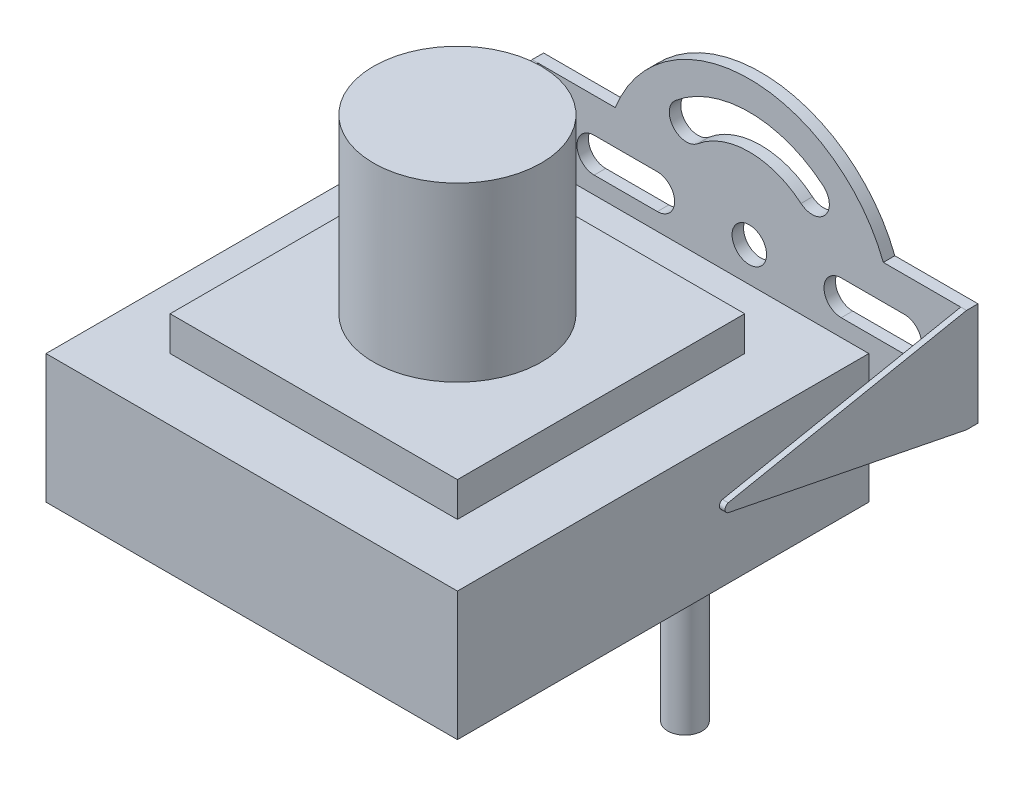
SolidWorks part; units mm, degrees
ref_plane "前视基准面" through (0, 0, 0) normal (0, 0, 1) x (1, 0, 0)
ref_plane "上视基准面" through (0, 0, 0) normal (0, 1, 0) x (1, 0, 0)
ref_plane "右视基准面" through (0, 0, 0) normal (1, 0, 0) x (0, 0, -1)
sketch "草图1" plane through (0, 0, 0) normal (0, 1, 0) x (1, 0, 0)
  line L1 (-17.9, -17.9) -> (17.9, -17.9)
  line L2 (-17.9, -17.9) -> (-17.9, 17.9)
  line L3 (-17.9, 17.9) -> (17.9, 17.9)
  line L4 (17.9, -17.9) -> (17.9, 17.9)
  line L5 (-17.9, -17.9) -> (17.9, 17.9) construction
  line L6 (-17.9, 17.9) -> (17.9, -17.9) construction
  point P0 (0, 0)
  dimension "D1" = 35.8
  dimension "D2" = 35.8
extrude "凸台-拉伸1" add sketch "草图1" along normal blind 11.2
sketch "草图2" plane through (0, 11.2, 0) normal (0, 1, 0) x (1, 0, 0)
  line L1 (-12.5, -12.5) -> (12.5, -12.5)
  line L2 (-12.5, -12.5) -> (-12.5, 12.5)
  line L3 (-12.5, 12.5) -> (12.5, 12.5)
  line L4 (12.5, -12.5) -> (12.5, 12.5)
  line L5 (-12.5, -12.5) -> (12.5, 12.5) construction
  line L6 (-12.5, 12.5) -> (12.5, -12.5) construction
  point P0 (0, 0)
  dimension "D1" = 25
  dimension "D2" = 25
extrude "凸台-拉伸2" add sketch "草图2" along normal blind 3
sketch "草图3" plane through (0, 14.2, 0) normal (0, 1, 0) x (1, 0, 0)
  circle A0 centre (0, 0) radius 7.3
  dimension "D1" = 14.6
extrude "凸台-拉伸3" add sketch "草图3" along normal blind 15
sketch "草图4" plane through (-17.9, 0, 0) normal (-1, 0, 0) x (0, 0, 1)
  line L0 (0, 0) -> (0, 8.5399) construction
  line L1 (-17.9, 0) -> (17.9, 0) construction
  line L2 (0, 0) -> (0, -7.5222) construction
  line L3 (-4.5, -7.5222) -> (4.5, -7.5222)
  line L4 (4.5, -7.5222) -> (1.2255, 8.786)
  line L5 (-4.5, -7.5222) -> (-1.2255, 8.786)
  arc A0 (1.2255, 8.786) -> (-1.2255, 8.786) centre (0, 8.5399) ccw
  dimension "D1" = 2.5
  dimension "D2" = 9
extrude "凸台-拉伸4" [suppressed] add sketch "草图4" along normal blind 0.5
mirror "镜向1" [suppressed] about plane through (0, 0, 0) normal (1, 0, 0)
sketch "草图5" [suppressed] plane through (0, -7.5222, 0) normal (0, -1, 0) x (1, 0, 0)
  line L0 (18.4, 4.5) -> (11.6619, 4.5)
  line L1 (18.4, 4.5) -> (18.4, -4.5)
  line L2 (18.4, -4.5) -> (11.6619, -4.5)
  line L3 (0, 0) -> (0, 2.2941) construction
  line L4 (-18.4, -4.5) -> (-11.6619, -4.5)
  line L5 (-18.4, 4.5) -> (-18.4, -4.5)
  line L6 (-18.4, 4.5) -> (-11.6619, 4.5)
  line L7 (-5.4637, 6.5114) -> (0, 0) construction
  line L8 (5.4637, 6.5114) -> (0, 0) construction
  line L9 (0, 0) -> (2.5677, 0) construction
  line L10 (8, 0) -> (13.5, 0) construction
  line L11 (8, 1.5) -> (13.5, 1.5)
  line L12 (8, -1.5) -> (13.5, -1.5)
  line L13 (-8, 0) -> (-13.5, 0) construction
  line L14 (-8, 1.5) -> (-13.5, 1.5)
  line L15 (-8, -1.5) -> (-13.5, -1.5)
  arc A0 (11.6619, 4.5) -> (-11.6619, 4.5) centre (0, 0) ccw
  arc A1 (-11.6619, -4.5) -> (11.6619, -4.5) centre (0, 0) ccw
  circle A2 centre (0, 0) radius 1.5
  circle A3 centre (0, 0) radius 7 construction
  circle A4 centre (0, 0) radius 10 construction
  arc A5 (-5.4637, 6.5114) -> (5.4637, 6.5114) centre (0, 0) cw construction
  arc A6 (6.4279, 7.6604) -> (-6.4279, 7.6604) centre (0, 0) ccw
  arc A7 (4.4995, 5.3623) -> (-4.4995, 5.3623) centre (0, 0) ccw
  arc A8 (4.4995, 5.3623) -> (6.4279, 7.6604) centre (5.4637, 6.5114) ccw
  arc A9 (-6.4279, 7.6604) -> (-4.4995, 5.3623) centre (-5.4637, 6.5114) ccw
  arc A10 (-5.4637, -6.5114) -> (5.4637, -6.5114) centre (0, 0) ccw construction
  arc A11 (6.4279, -7.6604) -> (-6.4279, -7.6604) centre (0, 0) cw
  arc A12 (4.4995, -5.3623) -> (-4.4995, -5.3623) centre (0, 0) cw
  arc A13 (4.4995, -5.3623) -> (6.4279, -7.6604) centre (5.4637, -6.5114) cw
  arc A14 (-6.4279, -7.6604) -> (-4.4995, -5.3623) centre (-5.4637, -6.5114) cw
  arc A15 (8, 1.5) -> (8, -1.5) centre (8, 0) ccw
  arc A16 (13.5, -1.5) -> (13.5, 1.5) centre (13.5, 0) ccw
  arc A17 (-8, 1.5) -> (-8, -1.5) centre (-8, 0) cw
  arc A18 (-13.5, -1.5) -> (-13.5, 1.5) centre (-13.5, 0) cw
  point P19 (0, 8.5)
  point P29 (0, -8.5)
  point P36 (10.75, 0)
  point P43 (-10.75, 0)
  dimension "D1" = 25
  dimension "D2" = 3
  dimension "D3" = 14
  dimension "D5" = 8.5
  dimension "D6" = 1.5
  dimension "D11" = 1.5
  dimension "D7" = 40
  dimension "D8" = 40
  dimension "D9" = 8
  dimension "D10" = 5.5
  dimension "D4" = 3
extrude "凸台-拉伸5" [suppressed] add sketch "草图5" along normal blind 0.5
sketch "草图6" plane through (0, 0, 0) normal (0, -1, 0) x (1, 0, 0)
  line L0 (17.9, 17.9) -> (17.9, -17.9) construction
  line L1 (17.9, -17.9) -> (-17.9, -17.9) construction
  circle A0 centre (6.4, -13.4) radius 1.5
  dimension "D2" = 4.5
  dimension "D3" = 3
  dimension "D1" = 11.5
extrude "凸台-拉伸6" add sketch "草图6" along normal blind 20
ref_plane "基准面1" through (0, 0, -25.4) normal (0, 0, -1) x (-1, 0, 0)
sketch "草图8" plane through (0, 0, -25.4) normal (0, 0, -1) x (-1, 0, 0)
  line L0 (18.4, 11.2) -> (11.6619, 11.2)
  line L1 (18.4, 11.2) -> (18.4, 2.2)
  line L2 (18.4, 2.2) -> (11.6619, 2.2)
  line L3 (0, 6.7) -> (0, 17.2371) construction
  line L4 (-18.4, 2.2) -> (-11.6619, 2.2)
  line L5 (-18.4, 11.2) -> (-18.4, 2.2)
  line L6 (-18.4, 11.2) -> (-11.6619, 11.2)
  line L7 (-5.4637, 13.2114) -> (0, 6.7) construction
  line L8 (5.4637, 13.2114) -> (0, 6.7) construction
  line L9 (0, 6.7) -> (3.055, 6.7) construction
  line L10 (8, 6.7) -> (13.5, 6.7) construction
  line L11 (8, 8.2) -> (13.5, 8.2)
  line L12 (8, 5.2) -> (13.5, 5.2)
  line L13 (-8, 6.7) -> (-13.5, 6.7) construction
  line L14 (-8, 8.2) -> (-13.5, 8.2)
  line L15 (-8, 5.2) -> (-13.5, 5.2)
  line L16 (0, 11.2) -> (0, 6.7) construction
  line L17 (-17.9, 11.2) -> (17.9, 11.2) construction
  arc A0 (11.6619, 11.2) -> (-11.6619, 11.2) centre (0, 6.7) ccw
  arc A1 (-11.6619, 2.2) -> (11.6619, 2.2) centre (0, 6.7) ccw
  circle A2 centre (0, 6.7) radius 1.5
  arc A5 (-5.4637, 13.2114) -> (5.4637, 13.2114) centre (0, 6.7) cw construction
  arc A6 (6.4279, 14.3604) -> (-6.4279, 14.3604) centre (0, 6.7) ccw
  arc A7 (4.4995, 12.0623) -> (-4.4995, 12.0623) centre (0, 6.7) ccw
  arc A8 (4.4995, 12.0623) -> (6.4279, 14.3604) centre (5.4637, 13.2114) ccw
  arc A9 (-6.4279, 14.3604) -> (-4.4995, 12.0623) centre (-5.4637, 13.2114) ccw
  arc A10 (-5.4637, 0.1886) -> (5.4637, 0.1886) centre (0, 6.7) ccw construction
  arc A11 (6.4279, -0.9604) -> (-6.4279, -0.9604) centre (0, 6.7) cw
  arc A12 (4.4995, 1.3377) -> (-4.4995, 1.3377) centre (0, 6.7) cw
  arc A13 (4.4995, 1.3377) -> (6.4279, -0.9604) centre (5.4637, 0.1886) cw
  arc A14 (-6.4279, -0.9604) -> (-4.4995, 1.3377) centre (-5.4637, 0.1886) cw
  arc A15 (8, 8.2) -> (8, 5.2) centre (8, 6.7) ccw
  arc A16 (13.5, 5.2) -> (13.5, 8.2) centre (13.5, 6.7) ccw
  arc A17 (-8, 8.2) -> (-8, 5.2) centre (-8, 6.7) cw
  arc A18 (-13.5, 5.2) -> (-13.5, 8.2) centre (-13.5, 6.7) cw
  point P16 (0, 15.2)
  point P26 (0, -1.8)
  point P33 (10.75, 6.7)
  point P40 (-10.75, 6.7)
  dimension "D2" = 10
  dimension "D3" = 8.5
  dimension "D5" = 12.5
  dimension "D7" = 5.5
  dimension "D8" = 16
  dimension "D9" = 1.5
  dimension "D10" = 1.5
  dimension "D12" = 4.5
  dimension "D13" = 3
  dimension "D1" = 36.8
  dimension "D4" = 40
  dimension "D6" = 9
  dimension "D11" = 40
extrude "凸台-拉伸8" add sketch "草图8" along normal blind 1 separate body
sketch "草图9" plane through (-18.4, 0, 0) normal (-1, 0, 0) x (0, 0, 1)
  line L0 (-25.4, 11.2) -> (-4.66, 7.0749)
  line L2 (-4.66, 6.3251) -> (-25.4, 2.2)
  line L3 (-26.4, 6.7) -> (3.132, 6.7) construction
  line L4 (-26.4, 2.2) -> (-26.4, 11.2) construction
  line L8 (-25.4, 2.2) -> (-25.4, 11.2)
  line L9 (-25.4, 11.2) -> (-26.4, 11.2)
  line L10 (-26.4, 11.2) -> (-26.4, 2.2)
  line L11 (-26.4, 2.2) -> (-25.4, 2.2)
  line L13 (-25.4, 11.2) -> (-26.4, 11.2)
  line L14 (-26.4, 11.2) -> (-26.4, 2.2)
  line L15 (-26.4, 2.2) -> (-25.4, 2.2)
  arc A0 (-4.66, 7.0749) -> (-4.66, 6.3251) centre (-4.7862, 6.7) cw
  dimension "D1" = 0
extrude "凸台-拉伸9" add sketch "草图9" along normal blind 0.5
mirror "镜向2" about plane through (0, 0, 0) normal (1, 0, 0) of "凸台-拉伸9"
